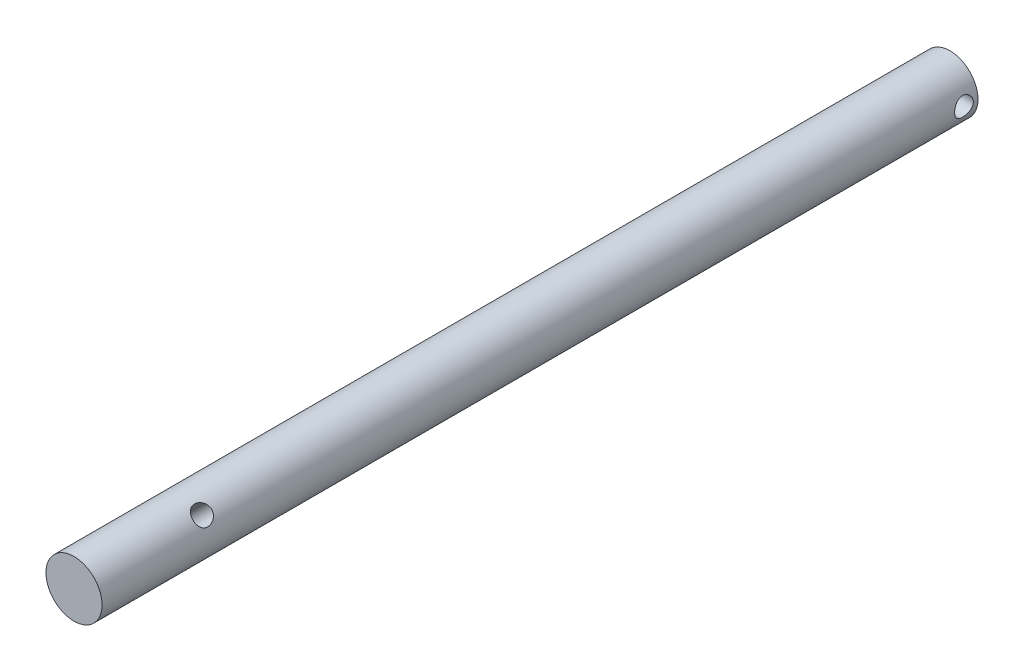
SolidWorks part; units mm, degrees
ref_plane "Face" through (0, 0, 0) normal (0, 0, 1) x (1, 0, 0)
ref_plane "Dessus" through (0, 0, 0) normal (0, 1, 0) x (1, 0, 0)
ref_plane "Droite" through (0, 0, 0) normal (1, 0, 0) x (0, 0, -1)
sketch "Esquisse1" plane through (0, 0, 0) normal (1, 0, 0) x (0, 0, -1)
  line L0 (-480, 0) -> (120, 0) construction
  line L1 (0, 0) -> (0, 15)
  line L2 (0, 15) -> (-468.41, 15)
  line L3 (-468.41, 15) -> (-468.41, 0)
  line L4 (0, 0) -> (-468.41, 0)
  dimension "D1" = 15
  dimension "D2" = 468.41
revolve "Base-Révolution" add sketch "Esquisse1" angle 360 about L0
sketch "Esquisse2" plane through (0, 0, 0) normal (1, 0, 0) x (0, 0, -1)
  line L0 (-480, 0) -> (120, 0) construction
  circle A0 centre (-7.5, 0) radius 5
  dimension "D1" = 10
  dimension "D2" = 7.5
extrude "Enlèv. mat.-Extru.1" cut sketch "Esquisse2" against normal through all and the other way through all
ref_plane "Plan2" through (0, 0, 0) normal (0.7071, -0.7071, 0) x (0, 0, -1)
ref_plane "Plan3" through (0, 0, 0) normal (-0.7071, -0.7071, 0) x (0.7071, -0.7071, 0)
sketch "Esquisse4" plane through (0, 0, 0) normal (-0.7071, -0.7071, 0) x (0.7071, -0.7071, 0)
  line L0 (0, -15.75) -> (0, 15.75) construction
  line L1 (15, 468.41) -> (-15, 468.41) construction
  circle A0 centre (0, 410.41) radius 5
  dimension "D1" = 10
  dimension "D2" = 58
extrude "Enlèv. mat.-Extru.2" cut sketch "Esquisse4" against normal through all and the other way through all
ref_plane "PLAN CENTRE ROTULE" through (0, 0, 36.44) normal (0, 0, -1) x (-1, 0, 0)
sketch "Esquisse5" plane through (0, 0, 36.44) normal (0, 0, -1) x (-1, 0, 0)
  circle A0 centre (0, 0) radius 15 construction
  point P0 (0, 0)
ref_plane "PLAN CENTRE LINEAIRE ANNULAIRE" through (0, 0, 329.44) normal (0, 0, -1) x (-1, 0, 0)
sketch "Esquisse6" plane through (0, 0, 329.44) normal (0, 0, -1) x (-1, 0, 0)
  point P0 (0, 0)
